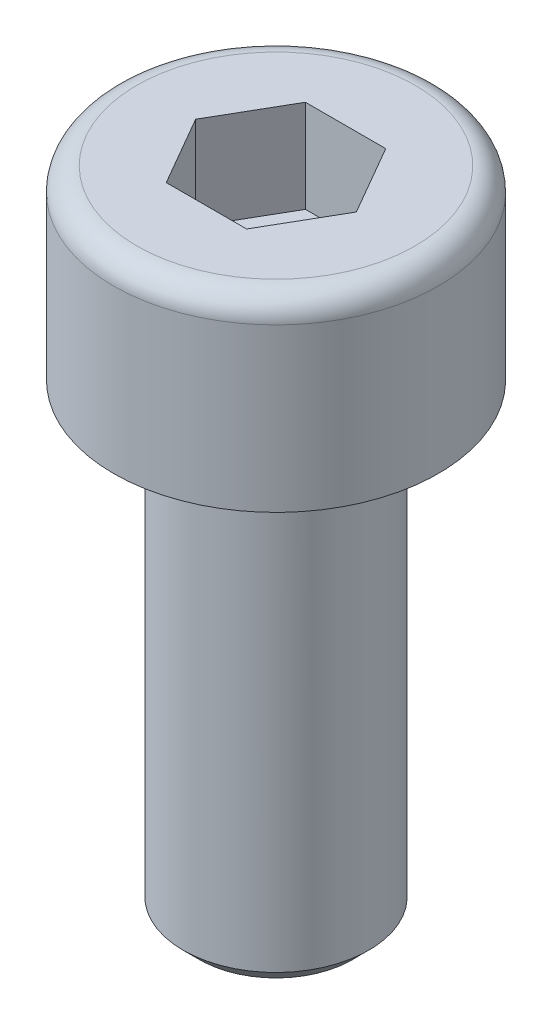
SolidWorks part; units mm, degrees
ref_plane "Plan1" through (0, 0, 0) normal (0, 0, 1) x (1, 0, 0)
ref_plane "Plan2" through (0, 0, 0) normal (0, 1, 0) x (1, 0, 0)
ref_plane "Plan3" through (0, 0, 0) normal (1, 0, 0) x (0, 0, -1)
sketch "Esquisse1" plane through (0, 0, 0) normal (0, 0, 1) x (1, 0, 0)
  line L0 (0, 21.7617) -> (0, -6.5178) construction
  line L1 (0, 14) -> (-3, 14)
  line L3 (-3.5, 13.5) -> (-3.5, 10)
  line L4 (-3.5, 10) -> (-2, 10)
  line L7 (-2, 10) -> (-2, 0)
  line L12 (-2, 0) -> (0, 0)
  line L13 (0, 14) -> (0, 0)
  arc A0 (-3.5, 13.5) -> (-3, 14) centre (-3, 13.5) cw
  dimension "D1" = 0.5
  dimension "D2" = 7
  dimension "D3" = 10
  dimension "D4" = 4
  dimension "D5" = 4
revolve "Base-Révolution" add sketch "Esquisse1" angle 360 about L0
sketch "Esquisse2" plane through (0, 14, 0) normal (0, 1, 0) x (-1, 0, 0)
  line L0 (0.866, -1.5) -> (-0.866, 1.5) construction
  line L1 (1.7321, 0) -> (-1.7321, 0) construction
  line L2 (-0.866, -1.5) -> (0.866, 1.5) construction
  line L3 (1.7321, 0) -> (0.866, -1.5)
  line L4 (0.866, -1.5) -> (-0.866, -1.5)
  line L5 (-0.866, -1.5) -> (-1.7321, 0)
  line L6 (-1.7321, 0) -> (-0.866, 1.5)
  line L7 (-0.866, 1.5) -> (0.866, 1.5)
  line L8 (0.866, 1.5) -> (1.7321, 0)
  dimension "D1" = 3
extrude "Enlèv. mat.-Extru.1" cut sketch "Esquisse2" against normal blind 2
chamfer "Chanfrein1" distance 0.35 angle 45
